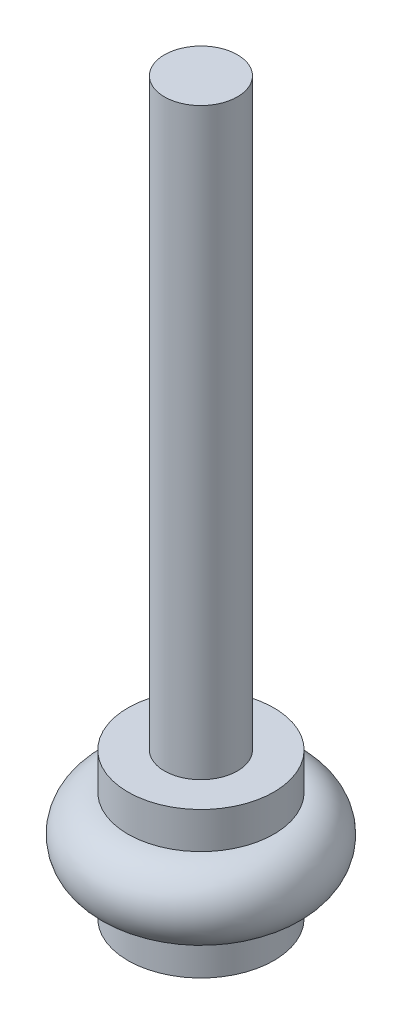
SolidWorks part; units mm, degrees
ref_plane "Front Plane" through (0, 0, 0) normal (0, 0, 1) x (1, 0, 0)
ref_plane "Top Plane" through (0, 0, 0) normal (0, 1, 0) x (1, 0, 0)
ref_plane "Right Plane" through (0, 0, 0) normal (1, 0, 0) x (0, 0, -1)
sketch "Sketch1" plane through (0, 0, 0) normal (0, 0, 1) x (1, 0, 0)
  line L0 (0, 0) -> (0, 63.5)
  line L1 (0, 63.5) -> (3.175, 63.5)
  line L2 (3.175, 63.5) -> (3.175, 12.7)
  line L3 (3.175, 12.7) -> (6.35, 12.7)
  line L4 (6.35, 12.7) -> (6.35, 9.525)
  line L5 (6.35, 0) -> (0, 0)
  line L6 (6.35, 3.175) -> (6.35, 0)
  line L7 (0, 0) -> (0, 63.5) construction
  line L8 (0, 0) -> (0, -5.6672) construction
  arc A0 (6.35, 3.175) -> (6.35, 9.525) centre (6.35, 6.35) ccw
  dimension "D2" = 6.35
  dimension "D1" = 63.5
  dimension "D3" = 12.7
  dimension "D4" = 3.175
  dimension "D5" = 6.35
revolve "Revolve1" add sketch "Sketch1" angle 360 about L8
